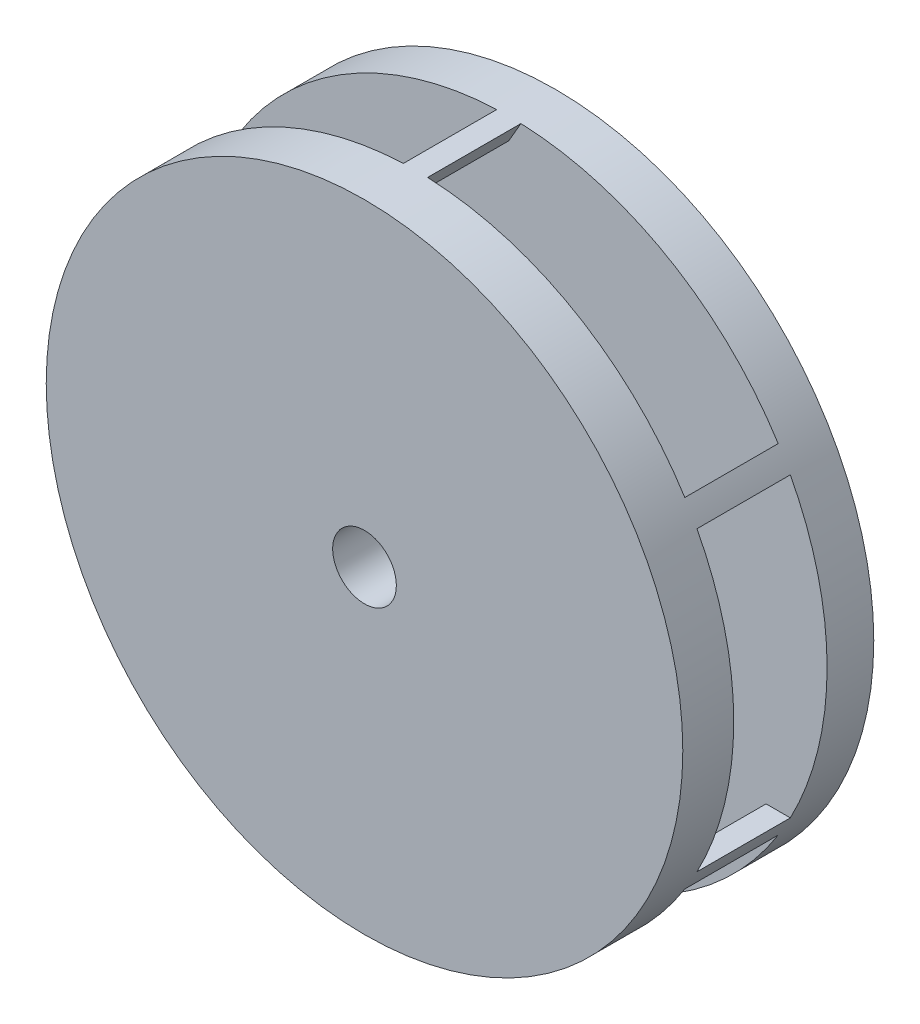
SolidWorks part; units mm, degrees
ref_plane "Alzado" through (0, 0, 0) normal (0, 0, 1) x (1, 0, 0)
ref_plane "Planta" through (0, 0, 0) normal (0, 1, 0) x (1, 0, 0)
ref_plane "Vista lateral" through (0, 0, 0) normal (1, 0, 0) x (0, 0, -1)
sketch "Croquis1" plane through (0, 0, 0) normal (0, 0, 1) x (1, 0, 0)
  circle A0 centre (0, 0) radius 75
  dimension "D1" = 150
extrude "Saliente-Extruir1" add sketch "Croquis1" along normal blind 45
sketch "Croquis3" plane through (0, 0, 0) normal (0, 0, -1) x (-1, 0, 0)
  circle A0 centre (0, 0) radius 30.5
  circle A1 centre (0, 0) radius 25.5
  dimension "D1" = 51
  dimension "D2" = 61
extrude "Saliente-Extruir2" add sketch "Croquis3" along normal blind 15
sketch "Croquis4" plane through (0, 0, 0) normal (0, 1, 0) x (1, 0, 0)
  line L0 (0, 0) -> (0, 26.0584) construction
  line L2 (-30.5, 0) -> (-65.5, 0)
  line L3 (75, 0) -> (-75, 0) construction
  line L4 (-30.5, 0) -> (-30.5, 9)
  line L5 (-30.5, 15) -> (-30.5, 0) construction
  spline S0 degree 2 poles (-65.5, 0) (-38.5214, 2.2767) (-30.5, 9) knots 0 0 0 0.452792 0.452792 0.452792
  dimension "D1" = 35
  dimension "D2" = 9
revolve "Revolución1" add sketch "Croquis4" angle 360 about L0
ref_plane "Plano1" through (37.5, -64.9519, 0) normal (0.5, -0.866, 0) x (0, 0, -1)
sketch "Croquis6" plane through (37.5, -64.9519, 0) normal (0.5, -0.866, 0) x (0, 0, -1)
  line L2 (-11, 0) -> (-11, 35)
  line L3 (-11, 35) -> (-33, 35)
  line L4 (-33, 35) -> (-33, -35)
  line L5 (-33, -35) -> (-11, -35)
  line L6 (-11, -35) -> (-11, 0)
  dimension "D1" = 11
  dimension "D2" = 22
  dimension "D3" = 35
  dimension "D4" = 70
extrude "Cortar-Extruir1" cut sketch "Croquis6" against normal up to next
ref_plane "Plano2" through (37.5, 64.9519, 0) normal (0.5, 0.866, 0) x (0, 0, -1)
sketch "Croquis7" plane through (37.5, 64.9519, 0) normal (0.5, 0.866, 0) x (0, 0, -1)
  line L1 (-11, 0) -> (-11, 35)
  line L2 (-11, 35) -> (-33, 35)
  line L3 (-33, 35) -> (-33, -35)
  line L4 (-33, -35) -> (-11, -35)
  line L5 (-11, -35) -> (-11, 0)
  dimension "D1" = 11
  dimension "D2" = 22
  dimension "D3" = 35
  dimension "D4" = 70
extrude "Cortar-Extruir2" cut sketch "Croquis7" against normal blind 174
ref_plane "Plano3" through (76.5, 0, 0) normal (1, 0, 0) x (0, 0, -1)
sketch "Croquis8" plane through (76.5, 0, 0) normal (1, 0, 0) x (0, 0, -1)
  line L1 (-11, 0) -> (-11, 35)
  line L2 (-11, 35) -> (-33, 35)
  line L3 (-33, 35) -> (-33, -35)
  line L4 (-33, -35) -> (-11, -35)
  line L5 (-11, -35) -> (-11, 0)
  dimension "D1" = 11
  dimension "D2" = 22
  dimension "D3" = 35
  dimension "D4" = 70
extrude "Cortar-Extruir3" cut sketch "Croquis8" against normal blind 153
sketch "Croquis9" plane through (0, 0, 0) normal (0, 0, -1) x (-1, 0, 0)
  circle A0 centre (0, 0) radius 25.5
  dimension "D1" = 51
extrude "Cortar-Extruir4" cut sketch "Croquis9" against normal up to next
sketch "Croquis10" plane through (0, 0, 45) normal (0, 0, 1) x (1, 0, 0)
  circle A0 centre (0, 0) radius 7.5
  dimension "D1" = 15
extrude "Cortar-Extruir5" cut sketch "Croquis10" against normal up to next
